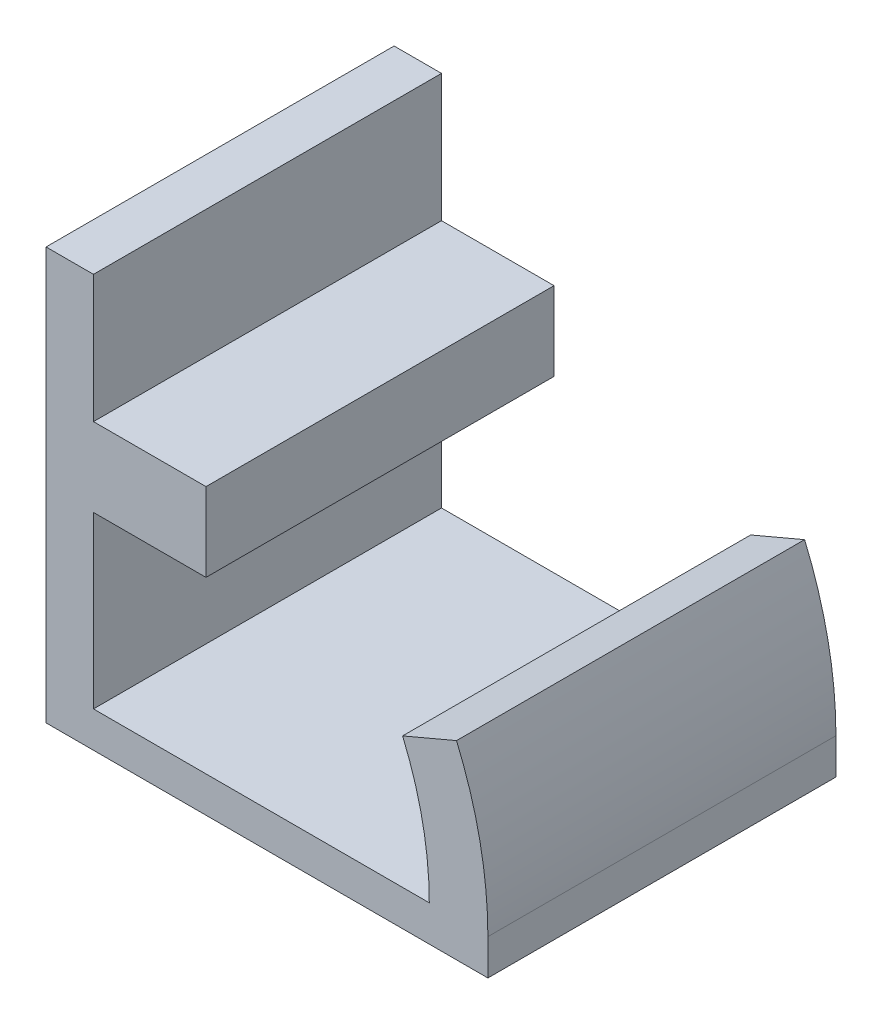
SolidWorks part; units mm, degrees
ref_plane "Front Plane" through (0, 0, 0) normal (0, 0, 1) x (1, 0, 0)
ref_plane "Top Plane" through (0, 0, 0) normal (0, 1, 0) x (1, 0, 0)
ref_plane "Right Plane" through (0, 0, 0) normal (1, 0, 0) x (0, 0, -1)
sketch "Sketch1" plane through (0, 0, 0) normal (0, 0, 1) x (1, 0, 0)
  line L0 (0, 157.5143) -> (0, 0)
  line L1 (0, 0) -> (168.8397, 0)
  line L2 (168.8397, 0) -> (168.8397, 13.6845)
  line L3 (168.8397, 13.6845) -> (18.1175, 13.6845)
  line L4 (18.1175, 13.6845) -> (18.1175, 157.5143)
  line L5 (18.1175, 157.5143) -> (0, 157.5143)
extrude "Boss-Extrude1" add sketch "Sketch1" along normal mid plane 133
sketch "Sketch3" plane through (18.1175, 0, 0) normal (1, 0, 0) x (0, 0, -1)
  line L0 (-66.5, 13.6845) -> (-66.5, 157.5143) construction
  line L1 (-66.5, 108.7619) -> (66.5, 108.7619)
  line L2 (-66.5, 108.7619) -> (-66.5, 78.7189)
  line L3 (-66.5, 78.7189) -> (66.5, 78.7189)
  line L4 (66.5, 108.7619) -> (66.5, 78.7189)
  line L5 (66.5, 13.6845) -> (66.5, 157.5143) construction
extrude "Boss-Extrude2" add sketch "Sketch3" along normal blind 43
sketch "Sketch2" plane through (0, 13.6845, 0) normal (0, 1, 0) x (-1, 0, 0)
  line L6 (-146.4482, 77.0597) -> (-146.4482, -76.6792)
revolve "Revolve2" add sketch "Sketch2" angle 23 about axis through (18.1175, 13.6845, 66.5) along (0, 0, -1)
